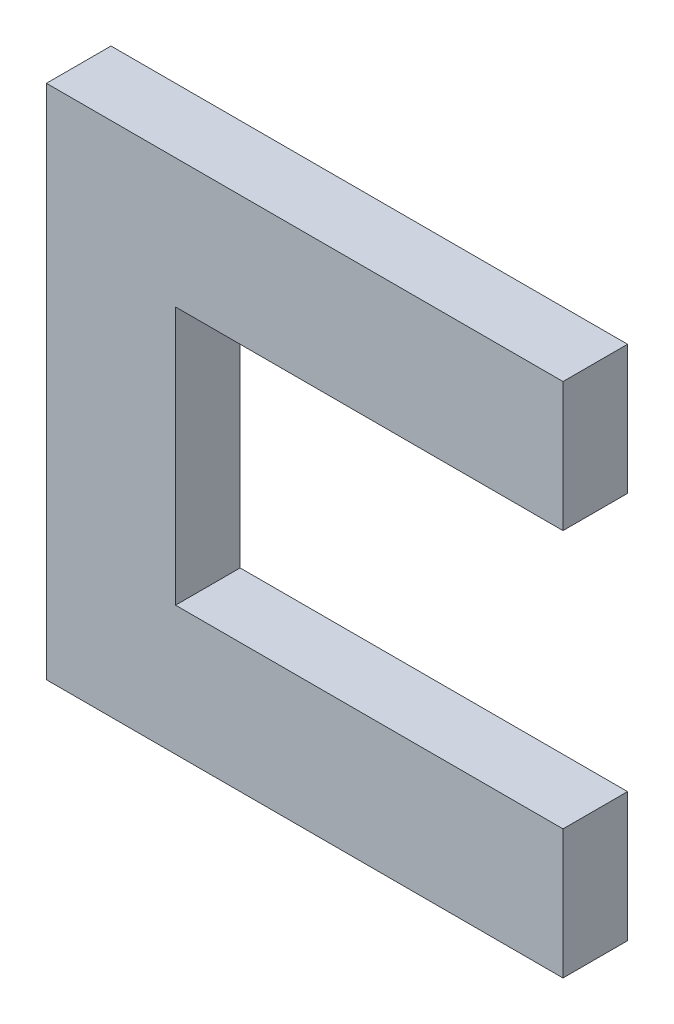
SolidWorks part; units mm, degrees
ref_plane "Front Plane" through (0, 0, 0) normal (0, 0, 1) x (1, 0, 0)
ref_plane "Top Plane" through (0, 0, 0) normal (0, 1, 0) x (1, 0, 0)
ref_plane "Right Plane" through (0, 0, 0) normal (1, 0, 0) x (0, 0, -1)
sketch "Sketch1" plane through (0, 0, 0) normal (0, 0, 1) x (1, 0, 0)
  line L0 (14.5217, 7.7339) -> (14.5217, 27.7339)
  line L1 (14.5217, 27.7339) -> (-65.4783, 27.7339)
  line L2 (-65.4783, 27.7339) -> (-65.4783, -52.2661)
  line L3 (-65.4783, -52.2661) -> (14.5217, -52.2661)
  line L4 (14.5217, -52.2661) -> (14.5217, -32.2661)
  line L5 (14.5217, -32.2661) -> (-45.4783, -32.2661)
  line L6 (-45.4783, -32.2661) -> (-45.4783, 7.7339)
  line L7 (-45.4783, 7.7339) -> (14.5217, 7.7339)
  dimension "D1" = 20
  dimension "D2" = 20
  dimension "D3" = 80
  dimension "D4" = 60
  dimension "D5" = 80
  dimension "D6" = 60
extrude "Extrude1" add sketch "Sketch1" along normal blind 10
